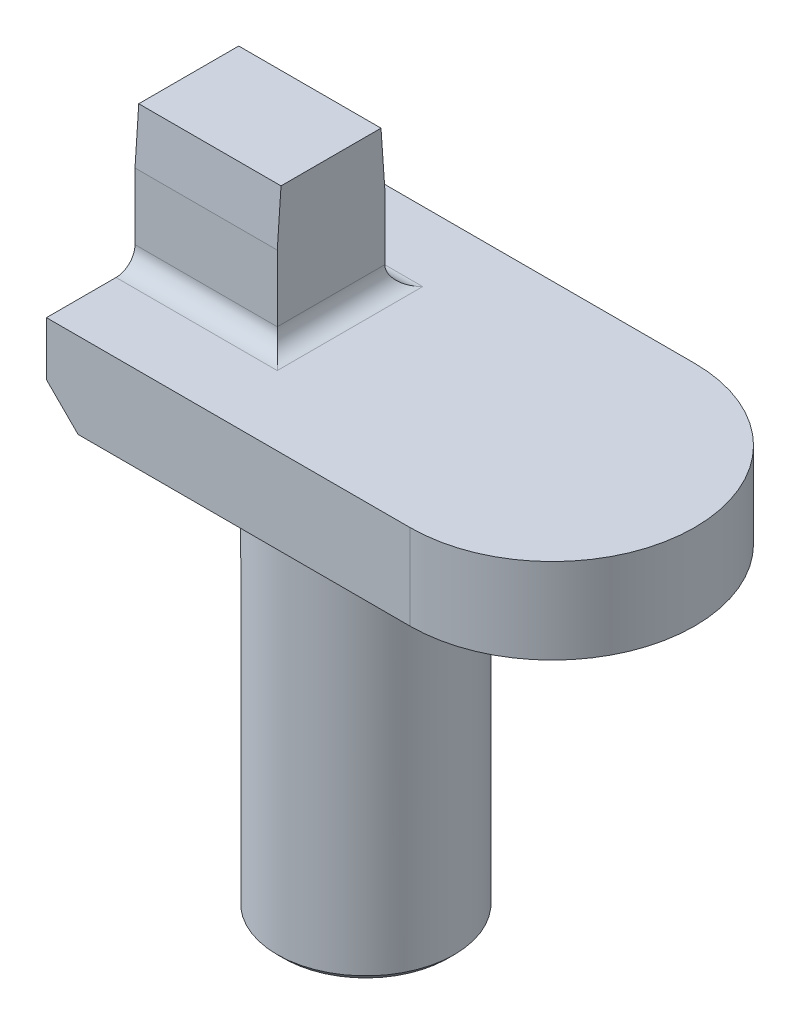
SolidWorks part; units mm, degrees
ref_plane "Front Plane" through (0, 0, 0) normal (0, 0, 1) x (1, 0, 0)
ref_plane "Top Plane" through (0, 0, 0) normal (0, 1, 0) x (1, 0, 0)
ref_plane "Right Plane" through (0, 0, 0) normal (1, 0, 0) x (0, 0, -1)
sketch "Sketch1" plane through (0, 0, 0) normal (0, 1, 0) x (1, 0, 0)
  line L0 (0, 0) -> (-7.112, 0) construction
  line L1 (0, 0) -> (13.208, 0) construction
  line L2 (0, 14.2638) -> (0, 0) construction
  line L3 (7.493, 5.715) -> (-7.112, 5.715)
  line L4 (-7.112, 5.715) -> (-7.112, -5.715)
  line L5 (7.493, -5.715) -> (-7.112, -5.715)
  arc A0 (7.493, -5.715) -> (7.493, 5.715) centre (7.493, 0) ccw
  point P10 (0, 0)
  point P11 (0, 0)
  point P12 (10.3793, 0)
  dimension "D3" = 5.715
  dimension "D1" = 7.112
  dimension "D2" = 14.605
extrude "Boss-Extrude1" add sketch "Sketch1" along normal blind 3.429
sketch "Sketch2" plane through (0, 0, 0) normal (0, -1, 0) x (1, 0, 0)
  line L0 (-7.112, -5.715) -> (-7.112, 5.715) construction
  circle A0 centre (0, 0) radius 3.556
  dimension "D1" = 7.112
  dimension "D2" = 7.112
extrude "Boss-Extrude2" add sketch "Sketch2" along normal blind 16.51
chamfer "Chamfer2" distance 0.254 angle 45 1 edges at (0, -16.51, -3.556)
sketch "Sketch3" plane through (0, 3.429, 0) normal (0, 1, 0) x (1, 0, 0)
  line L0 (-7.112, 0) -> (-1.397, 0) construction
  line L1 (-7.112, 5.715) -> (-7.112, -5.715) construction
  line L2 (-7.112, -2.159) -> (-1.397, -2.159)
  line L3 (-7.112, 2.159) -> (-1.397, 2.159)
  line L4 (-7.112, 2.159) -> (-7.112, -2.159)
  line L5 (-1.397, 2.159) -> (-1.397, -2.159)
  dimension "D1" = 5.715
  dimension "D2" = 2.159
  dimension "D3" = 2.159
extrude "Boss-Extrude3" add sketch "Sketch3" along normal blind 9.017 from surface at -3.429
chamfer "Chamfer1" distance 1.27 angle 45 1 edges at (-7.112, 0, 0)
fillet "Fillet1" radius 0.762 3 edges at (-4.2545, 3.429, -2.159) (-4.2545, 3.429, 2.159) (-1.397, 3.429, 0)
fillet "Fillet2" radius 0.762 1 edges at (0, 0, 3.556)
sketch "Sketch4" plane through (-7.112, 0, 0) normal (-1, 0, 0) x (0, 0, 1)
  line L0 (-2.159, 6.858) -> (-2.008, 9.017)
  line L2 (-2.159, 9.017) -> (2.159, 9.017) construction
  line L3 (-2.008, 9.017) -> (-2.159, 9.017)
  line L4 (-2.159, 9.017) -> (-2.159, 6.858)
  line L5 (0, 9.017) -> (0, 0) construction
  line L6 (2.008, 9.017) -> (2.159, 9.017)
  line L7 (2.159, 6.858) -> (2.008, 9.017)
  line L8 (2.159, 9.017) -> (2.159, 6.858)
  dimension "D1" = 4
  dimension "D2" = 2.159
extrude "Cut-Extrude1" cut sketch "Sketch4" against normal up to surface (5.715 mm away)
